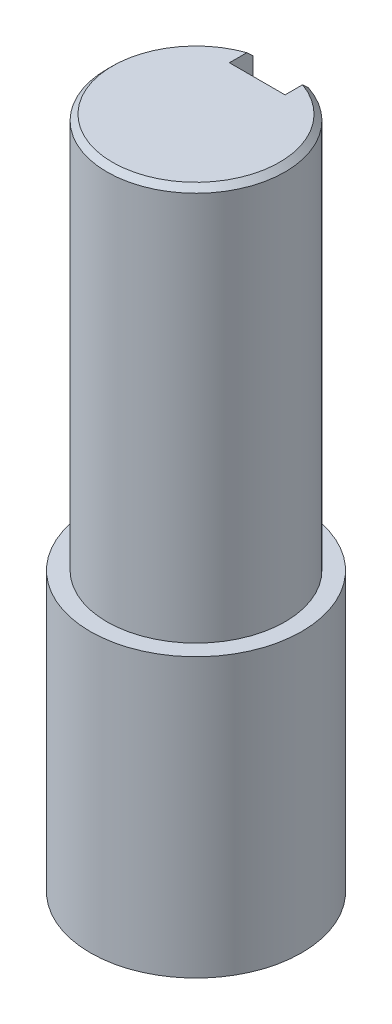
SolidWorks part; units mm, degrees
ref_plane "Front Plane" through (0, 0, 0) normal (0, 0, 1) x (1, 0, 0)
ref_plane "Top Plane" through (0, 0, 0) normal (0, 1, 0) x (1, 0, 0)
ref_plane "Right Plane" through (0, 0, 0) normal (1, 0, 0) x (0, 0, -1)
sketch "Sketch1" plane through (0, 0, 0) normal (0, 1, 0) x (1, 0, 0)
  circle A0 centre (0, 0) radius 16
  dimension "D1" = 32
extrude "Boss-Extrude1" add sketch "Sketch1" along normal blind 71
sketch "Sketch2" plane through (0, 71, 0) normal (0, 1, 0) x (1, 0, 0)
  line L0 (0, 16) -> (0, 0) construction
  line L1 (-5, 21) -> (5, 21)
  line L2 (-5, 21) -> (-5, 11)
  line L3 (-5, 11) -> (5, 11)
  line L4 (5, 21) -> (5, 11)
  line L5 (-5, 21) -> (5, 11) construction
  line L6 (-5, 11) -> (5, 21) construction
  circle A0 centre (0, 0) radius 16 construction
  point P0 (0, 16)
  dimension "D1" = 10
  dimension "D2" = 11
extrude "Cut-Extrude1" cut sketch "Sketch2" against normal blind 66
sketch "Sketch3" plane through (0, 0, 0) normal (0, -1, 0) x (1, 0, 0)
  circle A0 centre (0, 0) radius 19
  dimension "D1" = 38
extrude "Boss-Extrude2" add sketch "Sketch3" along normal blind 50
chamfer "Chamfer1" distance 1 angle 45 1 edges at (0, 71, 16)
